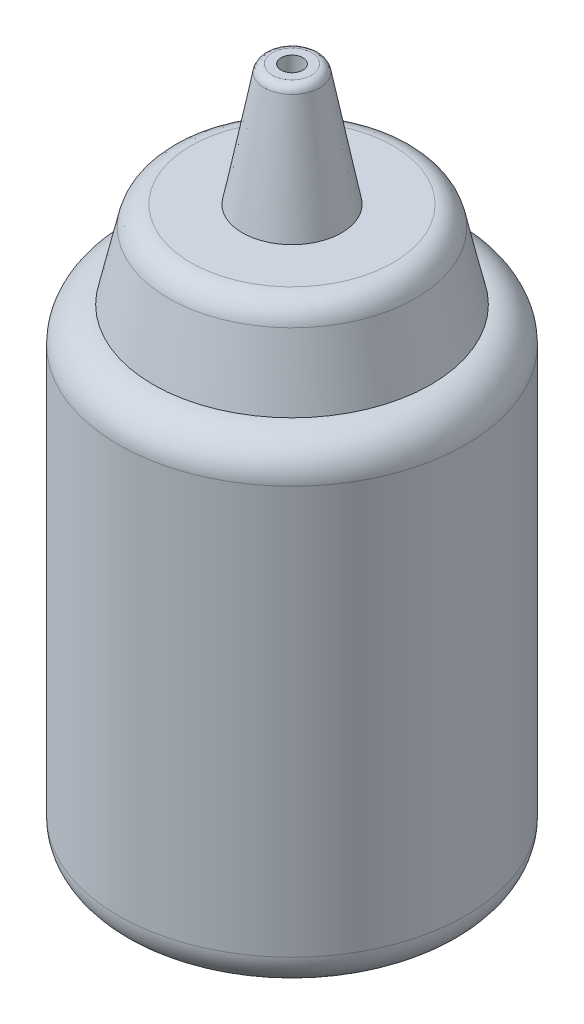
SolidWorks part; units mm, degrees
ref_plane "Front Plane" through (0, 0, 0) normal (0, 0, 1) x (1, 0, 0)
ref_plane "Top Plane" through (0, 0, 0) normal (0, 1, 0) x (1, 0, 0)
ref_plane "Right Plane" through (0, 0, 0) normal (1, 0, 0) x (0, 0, -1)
sketch "Sketch1" plane through (0, 0, 0) normal (0, 0, 1) x (1, 0, 0)
  line L0 (-20, 51.0001) -> (-20, 3.9999)
  line L1 (-16.0001, 0) -> (0, 0)
  line L2 (0, 0) -> (0, 79)
  line L3 (0, 79) -> (-2.2446, 79)
  line L4 (-3.1782, 78.1978) -> (-5.7143, 65)
  line L5 (-5.7143, 65) -> (-11.6625, 65)
  line L6 (-14.2466, 62.7408) -> (-16.0001, 55)
  spline S0 degree 3 poles (-16.0001, 55) (-18.2001, 55) (-20, 53.2001) (-20, 51.0001) knots 0 0 0 0 0.090909 0.090909 0.090909 0.090909
  spline S1 degree 3 poles (-20, 3.9999) (-20, 1.7999) (-18.2001, 0) (-16.0001, 0) knots 0.181818 0.181818 0.181818 0.181818 0.272727 0.272727 0.272727 0.272727
  spline S2 degree 3 poles (-2.2446, 79) (-2.7027, 79) (-3.0876, 78.6693) (-3.1782, 78.1978) knots 0.545455 0.545455 0.545455 0.545455 0.636364 0.636364 0.636364 0.636364
  spline S3 degree 3 poles (-11.6625, 65) (-12.8979, 65) (-13.9415, 64.0876) (-14.2466, 62.7408) knots 0.818182 0.818182 0.818182 0.818182 0.909091 0.909091 0.909091 0.909091
revolve "Revolve1" add sketch "Sketch1" angle 360 about L2
sketch "Sketch2" plane through (0, 79, 0) normal (0, 1, 0) x (1, 0, 0)
  circle A0 centre (0, 0) radius 1.25
extrude "Cut-Extrude1" cut sketch "Sketch2" against normal blind 10
